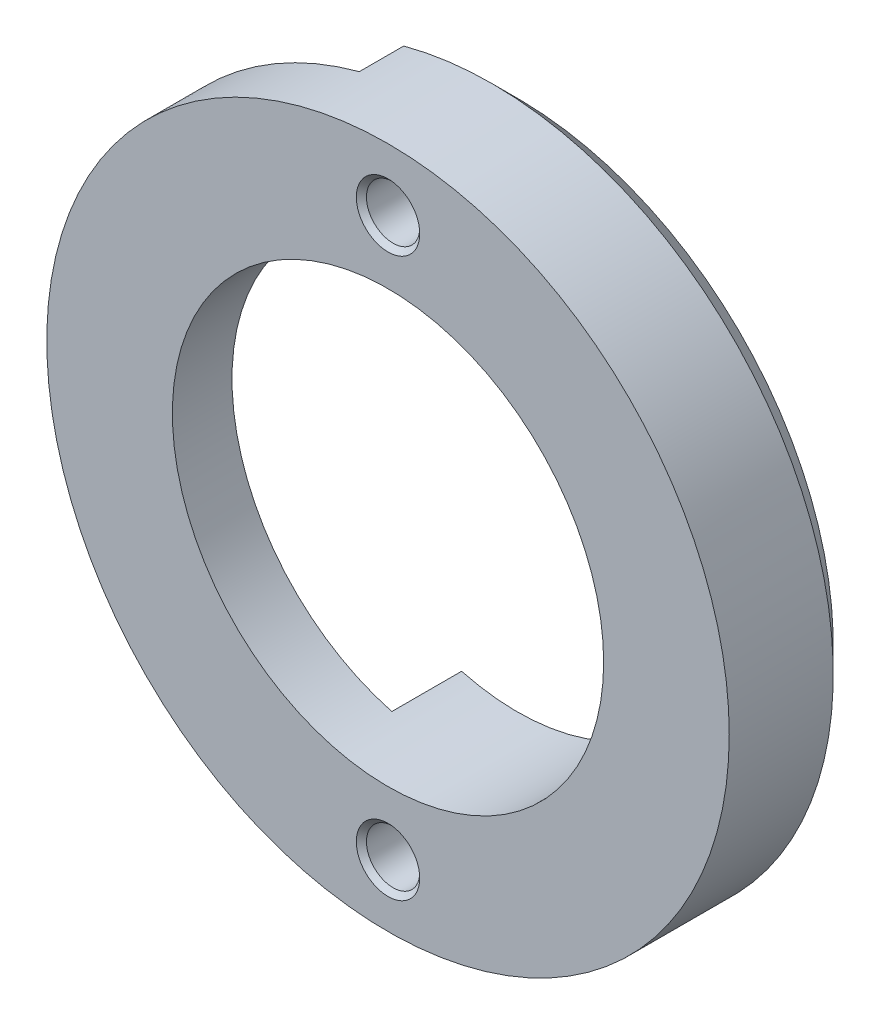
SolidWorks part; units mm, degrees
ref_plane "Face" through (0, 0, 0) normal (0, 0, 1) x (1, 0, 0)
ref_plane "Dessus" through (0, 0, 0) normal (0, 1, 0) x (1, 0, 0)
ref_plane "Droite" through (0, 0, 0) normal (1, 0, 0) x (0, 0, -1)
sketch "Esquisse1" plane through (0, 0, 0) normal (0, 0, 1) x (1, 0, 0)
  circle A0 centre (0, 0) radius 26.9
  circle A1 centre (0, 0) radius 17
  dimension "D1" = 53.8
  dimension "D2" = 34
extrude "Extrusion1" add sketch "Esquisse1" along normal blind 4.7
sketch "Esquisse2" plane through (0, 0, 0) normal (0, 0, -1) x (-1, 0, 0)
  line L0 (4.3999, 16.4207) -> (6.9622, 25.9834)
  line L1 (4.3999, -16.4207) -> (6.9622, -25.9834)
  line L2 (0, 0) -> (0, -17.3251) construction
  line L3 (0, 28.8998) -> (0, -29.082) construction
  line L4 (-31.0633, 0) -> (33.4977, 0) construction
  arc A0 (6.9622, 25.9834) -> (6.9622, -25.9834) centre (0, 0) ccw
  arc A2 (4.3999, 16.4207) -> (4.3999, -16.4207) centre (0, 0) ccw
  dimension "D1" = 53.8
  dimension "D4" = 17
  dimension "D3" = 150
extrude "Extrusion2" add sketch "Esquisse2" along normal blind 5.5
hole_wizard "Trou taraudé M5x0.81" positions "Esquisse4" profile "Esquisse3" tap size "M5x0.8" standard "DIN"
sketch "Esquisse4" plane through (0, 0, 4.7) normal (0, 0, 1) x (1, 0, 0)
  line L0 (0, 0) -> (-6.9622, 25.9834) construction
  line L1 (0, 0) -> (-6.9622, -25.9834) construction
  line L2 (0, 28.5303) -> (0, -29.436) construction
  line L4 (-6.9622, -25.9834) -> (-4.3999, -16.4207) construction
  circle A0 centre (0, 0) radius 22 construction
  circle A1 centre (0, 0) radius 26.9 construction
  point P0 (0, -22)
  point P1 (0, 22)
  dimension "D2" = 44
sketch "Esquisse3" plane through (0, -22, 4.7) normal (1, 0, 0) x (0, -1, 0)
  line L0 (0, 0) -> (0, 10.2)
  line L1 (0, 10.2) -> (2.1, 10.2)
  line L2 (2.1, 10.2) -> (2.1, 0.4)
  line L3 (2.1, 0.4) -> (2.5, 0)
  line L5 (2.5, 0) -> (0, 0)
  line L6 (-2.1, 0.4) -> (-2.5, 0) construction
  line L11 (0, -6.35) -> (0, 107.95) construction
  dimension "Diamètre du trou pour taraudage jusqu'au prochain" = 4.2
  dimension "Profondeur du trou pour taraudage jusqu'au prochain" = 10.2
  dimension "Diamètre du fraisage entrant" = 5
  dimension "Angle du fraisage entrant" = 90
chamfer "Chanfrein1" distance 2 angle 45 1 edges at (26.9, 0, -5.5)
